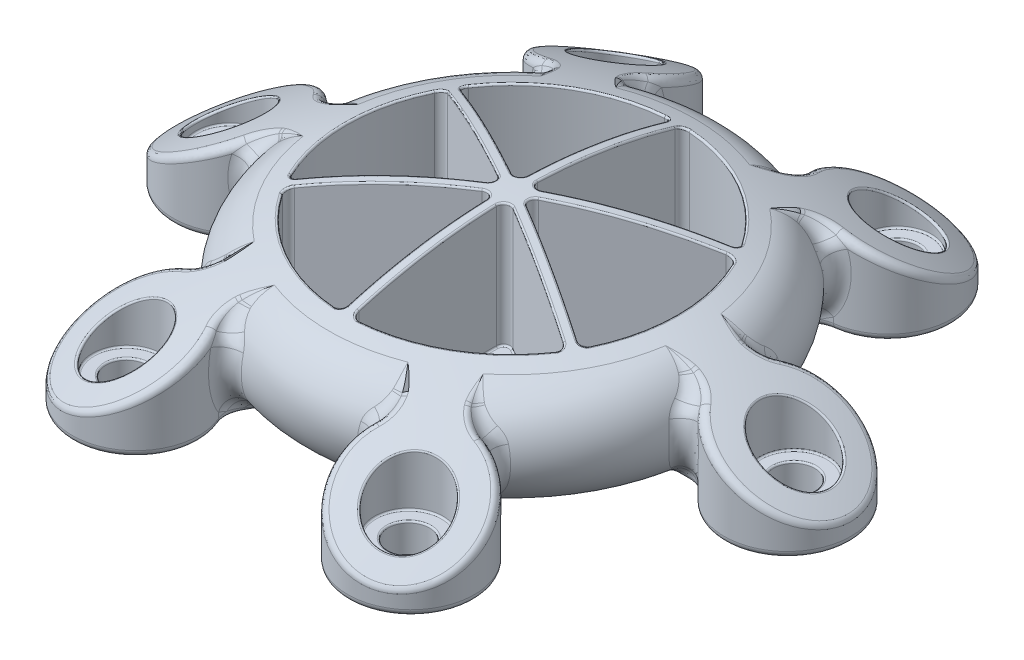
SolidWorks part; units mm, degrees
ref_plane "Front Plane" through (0, 0, 0) normal (0, 0, 1) x (1, 0, 0)
ref_plane "Top Plane" through (0, 0, 0) normal (0, 1, 0) x (1, 0, 0)
ref_plane "Right Plane" through (0, 0, 0) normal (1, 0, 0) x (0, 0, -1)
sketch "Sketch1" plane through (0, 0, 0) normal (0, 0, 1) x (1, 0, 0)
  line L0 (0, 0) -> (0, 31.75)
  line L1 (0, 0) -> (38.1, 0)
  line L2 (0, 0) -> (0, 41.7951) construction
  arc A0 (38.1, 0) -> (42.2745, 24.6943) centre (38.1, 12.7) ccw
  arc A1 (42.2745, 24.6943) -> (0, 31.75) centre (0.5297, -95.2489) ccw
  point P5 (0, 0)
  dimension "D3" = 12.7
  dimension "D4" = 127
  dimension "D1" = 31.75
  dimension "D2" = 50.8
revolve "Revolve1" add sketch "Sketch1" angle 360 about L2
sketch "Sketch2" plane through (0, 0, 0) normal (0, 1, 0) x (1, 0, 0)
  line L0 (0, 0) -> (89.2688, 0) construction
  line L1 (46.832, 6.35) -> (37.5671, 6.35)
  line L2 (46.832, -6.35) -> (37.5671, -6.35)
  arc A1 (37.5671, -6.35) -> (37.5671, 6.35) centre (0, 0) ccw
  arc A2 (51.8829, -8.8515) -> (51.8829, 8.8515) centre (63.5, 0) ccw
  arc A3 (51.8829, -8.8515) -> (46.832, -6.35) centre (46.832, -12.7) ccw
  arc A4 (51.8829, 8.8515) -> (46.832, 6.35) centre (46.832, 12.7) cw
  circle A7 centre (0, 0) radius 38.1 construction
  dimension "D2" = 14.605
  dimension "D4" = 6.35
  dimension "D1" = 12.7
  dimension "D3" = 63.5
extrude "Boss-Extrude1" add sketch "Sketch2" along normal up to surface (20.5712 mm away)
sketch "Sketch3" plane through (0, 0, 0) normal (0, 0, 1) x (1, 0, 0)
  line L0 (64.994, -1.016) -> (64.994, 19.304)
  line L1 (51.8829, 0) -> (78.105, 0) construction
  line L2 (64.994, 19.304) -> (57.0565, 19.304)
  line L3 (57.0565, 19.304) -> (57.0565, 6.604)
  line L4 (57.0565, 6.604) -> (60.2315, 6.604)
  line L5 (60.2315, 6.604) -> (60.2315, -1.016)
  line L6 (64.994, -1.016) -> (60.2315, -1.016)
  line L7 (64.994, 0) -> (64.994, 28.0312) construction
  dimension "D1" = 20.32
  dimension "D2" = 12.7
  dimension "D3" = 15.875
  dimension "D4" = 9.525
  dimension "D5" = 1.016
revolve "Cut-Revolve1" cut sketch "Sketch3" angle 360 about L7
pattern_circular "CirPattern1" count 6 over 360 about axis through (0, 0, 0) along (0, 1, 0) of "Boss-Extrude1", "Cut-Revolve1"
ref_plane "Plane1" through (0, 33.02, 0) normal (0, 1, 0) x (1, 0, 0)
sketch "Sketch4" plane through (0, 33.02, 0) normal (0, 1, 0) x (1, 0, 0)
  line L0 (0, 0) -> (118.0619, 0) construction
  line L1 (32.0919, 17.2084) -> (4.6863, 1.3858)
  line L2 (4.6863, -1.3858) -> (32.0919, -17.2084)
  line L3 (0, 0) -> (0, 68.9395) construction
  line L4 (0, 0) -> (78.5172, 45.3319) construction
  arc A0 (34.334, -16.5163) -> (34.334, 16.5163) centre (0, 0) ccw
  arc A1 (32.0919, 17.2084) -> (34.334, 16.5163) centre (32.892, 15.8226) cw
  arc A2 (34.334, -16.5163) -> (32.0919, -17.2084) centre (32.892, -15.8226) cw
  arc A3 (4.6863, -1.3858) -> (4.6863, 1.3858) centre (5.4864, 0) cw
  point P12 (2.286, 0)
  dimension "D1" = 38.1
  dimension "D3" = 1.6002
  dimension "D2" = 30
  dimension "D4" = 1.143
  dimension "D5" = 60
extrude "Cut-Extrude1" cut sketch "Sketch4" against normal offset from surface (29.845 mm away) 3.175
pattern_circular "CirPattern2" count 6 over 360 about axis through (0, 0, 0) along (0, 1, 0) of "Cut-Extrude1"
fillet "Fillet1" radius 1.5875 66 edges at (-26.599, 0, -33.3709) (-15.4283, 0.7266, -39.4227) (-15.6005, 0, -39.7209) (-18.7546, 0, -46.5032) (-39.0525, 0, -67.6409) (-30.8956, 0, -39.4935) (-18.6861, 21.908, -45.8946) (-39.9876, 5.3311, -67.0528) (-31.4566, 21.3993, -39.8267) (15.6005, 0, -39.7209) (26.4269, 0.7266, -33.0727) (26.599, 0, -33.3709) (30.8956, 0, -39.4935) (39.0525, 0, -67.6409) (18.7546, 0, -46.5032) (30.4028, 21.908, -39.13) (39.3759, 5.308, -67.4486) (18.7626, 21.3993, -47.1556) (33.3999, 24.7194, 6.35) (49.6502, 0, 7.0096) (78.105, 0, 0) (49.6502, 0, -7.0096) (42.1996, 0, -6.35) (42.1996, 0, 6.35) (-31.3391, -218.2942, 6.35) (49.089, 21.908, 6.7646) (78.1002, 5.308, 0.3749) (50.2193, 21.3993, -7.3289) (15.4283, 0.7266, 39.4227) (26.599, 0, 33.3709) (18.7546, 0, 46.5032) (39.0525, 0, 67.6409) (30.8956, 0, 39.4935) (15.6005, 0, 39.7209) (18.6861, 21.908, 45.8946) (39.9876, 5.3311, 67.0528) (31.4566, 21.3993, 39.8267) (-15.6005, 0, 39.7209) (-26.4269, 0.7266, 33.0727) (-30.8956, 0, 39.4935) (-39.0525, 0, 67.6409) (-18.7546, 0, 46.5032) (-26.599, 0, 33.3709) (-30.4028, 21.908, 39.13) (-39.3759, 5.308, 67.4486) (-18.7626, 21.3993, 47.1556) (-33.3999, 24.7194, -6.35) (-49.6502, 0, -7.0096) (-78.105, 0, 0) (-49.6502, 0, 7.0096) (-42.1996, 0, 6.35) (-42.1996, 0, -6.35) (52.6767, -210.8766, 6.35) (30.4425, -218.5153, -6.35) (-49.089, 21.908, -6.7646) (-78.1002, 5.308, -0.3749) (-50.2193, 21.3993, 7.3289)
fillet "Fillet4" radius 3.175 60 edges at (-28.2859, 22.6331, -36.2926) (-50.0849, 10.4909, -7.2464) (-41.4864, 0.5873, -5.9953) (-25.9353, 0.5873, -32.9306) (-31.318, 14.9091, -39.7516) (-27.1787, 24.0383, 34.3748) (-31.318, 10.4909, 39.7516) (-28.3295, 2.8363, 36.3681) (-25.9353, 0.5873, 32.9306) (-41.4864, 0.5873, 5.9953) (-50.0849, 14.9091, 7.2464) (17.2873, 22.6331, -42.6426) (-16.1801, 24.0383, -40.7248) (-18.7668, 10.4909, -46.998) (-17.331, 2.8363, -42.7181) (-15.5511, 0.5873, -38.9259) (15.5511, 0.5873, -38.9259) (18.7668, 14.9091, -46.998) (41.4864, 0.5873, -5.9953) (50.0849, 14.9091, -7.2464) (27.1787, 24.0383, -34.3748) (31.318, 10.4909, -39.7516) (28.3295, 2.8363, -36.3681) (25.9353, 0.5873, -32.9306) (28.2859, 22.6331, 36.2926) (50.0849, 10.4909, 7.2464) (41.4864, 0.5873, 5.9953) (25.9353, 0.5873, 32.9306) (31.318, 14.9091, 39.7516) (-17.2873, 22.6331, 42.6426) (16.1801, 24.0383, 40.7248) (18.7668, 10.4909, 46.998) (17.331, 2.8363, 42.7181) (15.5511, 0.5873, 38.9259) (-15.5511, 0.5873, 38.9259) (-18.7668, 14.9091, 46.998)
fillet "Fillet3" radius 0.381 90 edges at (64.994, 6.604, -7.9375) (64.994, 6.604, -4.7625) (39.3711, 6.604, 52.3177) (36.6214, 6.604, 53.9052) (-25.6229, 6.604, 60.2552) (-28.3725, 6.604, 58.6677) (-64.994, 6.604, 7.9375) (-64.994, 6.604, 4.7625) (-39.3711, 6.604, -52.3177) (-36.6214, 6.604, -53.9052) (35.4708, 16.7364, -48.927) (-61.0097, 16.2161, 6.8651) (37.4495, 9.1471, 62.4894) (69.0468, 11.4666, 6.8248) (-25.5162, 14.0172, 60.0642) (-28.0666, 18.4671, -49.7004) (3.8872, 31.7067, -0.0564) (3.8862, 3.175, 0) (8.9143, 31.4195, 3.8268) (18.3891, 3.175, 9.2971) (33.1769, 26.2626, 17.3972) (33.3639, 3.175, 17.3516) (38.1, 26.0667, 0) (38.1, 3.175, 0) (33.62, 26.1635, -17.2476) (33.3639, 3.175, -17.3516) (18.3891, 3.175, -9.2971) (1.9925, 31.7067, 3.3382) (1.9431, 3.175, 3.3655) (1.143, -222.2474, 0) (1.143, 3.175, 20.574) (1.522, 26.2626, 37.4307) (1.655, 3.175, 37.5698) (19.05, 26.0667, 32.9956) (19.05, 3.175, 32.9956) (31.7469, 26.1635, 20.492) (31.7089, 3.175, 20.2182) (17.2461, 3.175, 11.2768) (-1.8948, 31.7067, 3.3946) (-1.9431, 3.175, 3.3655) (-7.7713, 31.4195, 5.8066) (-17.2461, 3.175, 11.2768) (-31.6549, 26.2626, 20.0334) (-31.7089, 3.175, 20.2182) (-19.05, 26.0667, 32.9956) (-19.05, 3.175, 32.9956) (-1.8731, 26.1635, 37.7396) (-1.655, 3.175, 37.5698) (-1.143, 3.175, 20.574) (-3.8872, 31.7067, 0.0564) (-3.8862, 3.175, 0) (-8.9143, 31.4195, -3.8268) (-18.3891, 3.175, -9.2971) (-33.1769, 26.2626, -17.3972) (-33.3639, 3.175, -17.3516) (-38.1, 26.0667, 0) (-38.1, 3.175, 0) (-33.62, 26.1635, 17.2476) (-33.3639, 3.175, 17.3516) (-18.3891, 3.175, 9.2971) (-1.9925, 31.7067, -3.3382) (-1.9431, 3.175, -3.3655) (-1.143, -222.2474, 0) (-1.143, 3.175, -20.574) (-1.522, 26.2626, -37.4307) (-1.655, 3.175, -37.5698) (-19.05, 26.0667, -32.9956) (-19.05, 3.175, -32.9956) (-31.7469, 26.1635, -20.492) (-31.7089, 3.175, -20.2182) (-17.2461, 3.175, -11.2768) (1.8948, 31.7067, -3.3946) (1.9431, 3.175, -3.3655) (7.7713, 31.4195, -5.8066) (17.2461, 3.175, -11.2768) (31.6549, 26.2626, -20.0334) (31.7089, 3.175, -20.2182) (19.05, 26.0667, -32.9956) (19.05, 3.175, -32.9956) (1.8731, 26.1635, -37.7396) (1.655, 3.175, -37.5698) (1.143, 3.175, -20.574) (25.6229, 6.604, -60.2552) (28.3725, 6.604, -58.6677)
